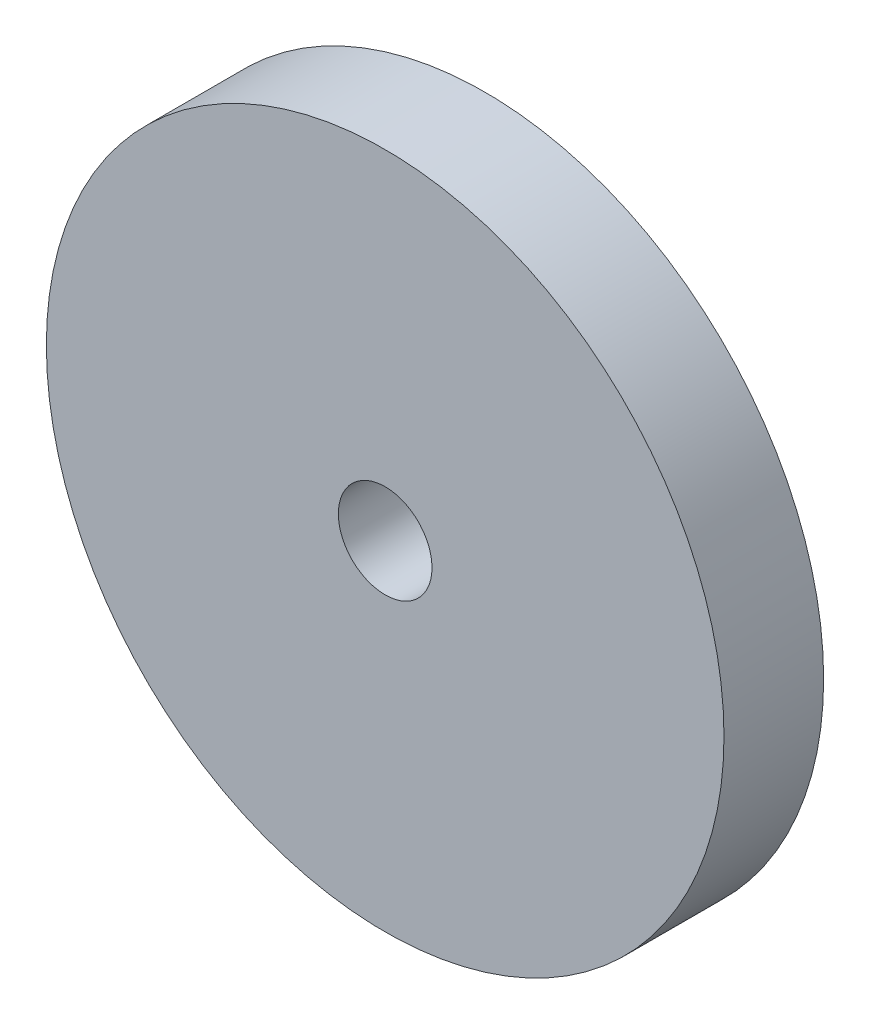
SolidWorks part; units mm, degrees
ref_plane "Alzado" through (0, 0, 0) normal (0, 0, 1) x (1, 0, 0)
ref_plane "Planta" through (0, 0, 0) normal (0, 1, 0) x (1, 0, 0)
ref_plane "Vista lateral" through (0, 0, 0) normal (1, 0, 0) x (0, 0, -1)
sketch "Croquis1" plane through (0, 0, 0) normal (0, 0, 1) x (1, 0, 0)
  circle A0 centre (0, 0) radius 2.35
  circle A1 centre (0, 0) radius 17
  dimension "D1" = 4.7
  dimension "D2" = 34
extrude "Saliente-Extruir1" add sketch "Croquis1" along normal mid plane 5
sketch "Croquis2" plane through (0, 0, 2.5) normal (0, 0, 1) x (1, 0, 0)
  line L0 (0, 0) -> (0, 18.1672) construction
  line L1 (0, 0) -> (13.1275, 15.6447) construction
  line L2 (0, 12) -> (5.9088, 7.0419) construction
  circle A0 centre (0, 0) radius 17
  circle A1 centre (0, 0) radius 12
  circle A2 centre (0, 0) radius 5.75
  circle A3 centre (5.9088, 7.0419) radius 7.7135
  dimension "D1" = 34
  dimension "D2" = 24
  dimension "D3" = 11.5
  dimension "D4" = 40
